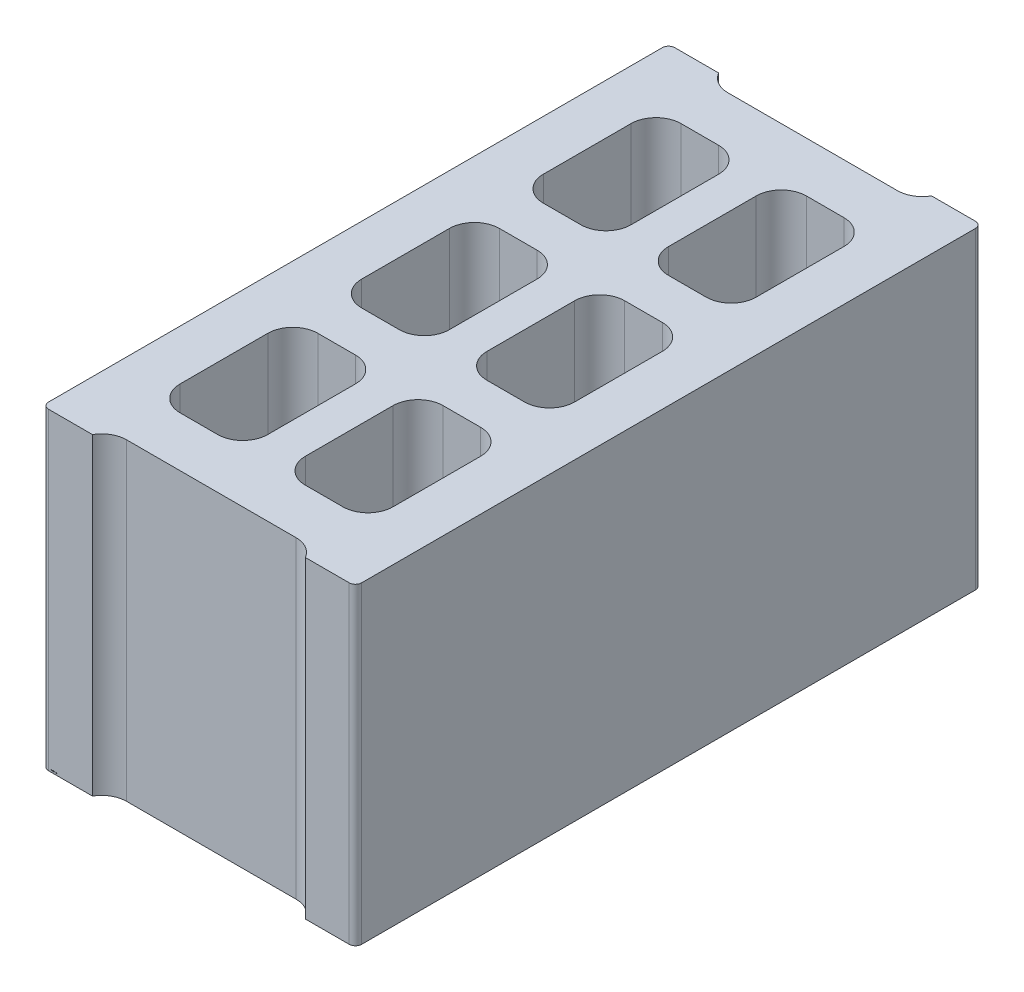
SolidWorks part; units mm, degrees
ref_plane "Plan de face" through (0, 0, 0) normal (0, 0, 1) x (1, 0, 0)
ref_plane "Plan de dessus" through (0, 0, 0) normal (0, 1, 0) x (1, 0, 0)
ref_plane "Plan de droite" through (0, 0, 0) normal (1, 0, 0) x (0, 0, -1)
sketch "Esquisse1" plane through (0, 0, 0) normal (0, 1, 0) x (1, 0, 0)
  line L0 (0, -20.2628) -> (0, 58.4186) construction
  line L1 (-24.3225, 0) -> (29.7425, 0) construction
  line L2 (25, -20.2628) -> (25, 58.4186) construction
  line L3 (-24.3225, 50) -> (34.6841, 50) construction
  line L4 (4, 55.6667) -> (4, -3.7395) construction
  line L5 (-3.5126, 49) -> (27.2256, 49) construction
  line L6 (-17.7609, 25) -> (23.5775, 25) construction
  line L7 (12.5, 55.6667) -> (12.5, -13.5587) construction
  line L8 (21, 0) -> (24.5, 0)
  line L9 (21, 55.6667) -> (21, -3.7395) construction
  line L10 (-3.5126, 1) -> (27.2256, 1) construction
  line L11 (4, 49) -> (21, 49)
  line L12 (4, 49) -> (4, 50)
  line L14 (21, 49) -> (21, 50)
  line L15 (4, 1) -> (21, 1)
  line L16 (4, 1) -> (4, 0)
  line L17 (21, 50) -> (24.5, 50)
  line L18 (21, 1) -> (21, 0)
  line L19 (0.5, 50) -> (4, 50)
  line L20 (0, 49.5) -> (0, 0.5)
  line L21 (0.5, 0) -> (4, 0)
  line L22 (25, 49.5) -> (25, 0.5)
  arc A0 (0.5, 50) -> (0, 49.5) centre (0.5, 49.5) ccw
  arc A1 (24.5, 50) -> (25, 49.5) centre (24.5, 49.5) cw
  arc A2 (24.5, 0) -> (25, 0.5) centre (24.5, 0.5) ccw
  arc A3 (0, 0.5) -> (0.5, 0) centre (0.5, 0.5) ccw
  dimension "D6" = 0.5
  dimension "D1" = 25
  dimension "D2" = 50
  dimension "D3" = 25
  dimension "D4" = 12.5
  dimension "D5" = 4
  dimension "D7" = 1
extrude "Extrusion1" add sketch "Esquisse1" along normal blind 25
sketch "Esquisse2" plane through (0, 0, 0) normal (0, -1, 0) x (1, 0, 0)
  line L0 (0, 2.4119) -> (0, -60.8727) construction
  line L1 (-5.7031, 0) -> (29.0572, 0) construction
  line L2 (29.0572, -25) -> (-5.7031, -25) construction
  line L3 (12.5, 9.4676) -> (12.5, -60.8727) construction
  line L4 (4, 9.4676) -> (4, -52.8814) construction
  line L5 (14, -16) -> (14, -5)
  line L6 (-5.7031, -5) -> (39.022, -5) construction
  line L7 (-5.7031, -16) -> (39.022, -16) construction
  line L8 (-5.7031, -19.5) -> (39.022, -19.5) construction
  line L9 (11, -52.8814) -> (11, 9.4676) construction
  line L10 (-5.7031, -45) -> (39.022, -45) construction
  line L11 (-5.7031, -34) -> (39.022, -34) construction
  line L12 (-5.7031, -30.5) -> (39.022, -30.5) construction
  line L13 (4, -45) -> (11, -45)
  line L14 (4, -45) -> (4, -34)
  line L15 (4, -34) -> (11, -34)
  line L16 (11, -45) -> (11, -34)
  line L17 (4, -30.5) -> (11, -30.5)
  line L18 (4, -30.5) -> (4, -19.5)
  line L19 (4, -19.5) -> (11, -19.5)
  line L20 (11, -30.5) -> (11, -19.5)
  line L21 (4, -16) -> (11, -16)
  line L22 (4, -16) -> (4, -5)
  line L23 (4, -5) -> (11, -5)
  line L24 (11, -16) -> (11, -5)
  line L25 (21, -5) -> (14, -5)
  line L26 (21, -16) -> (21, -5)
  line L27 (21, -16) -> (14, -16)
  line L28 (14, -30.5) -> (14, -19.5)
  line L29 (21, -19.5) -> (14, -19.5)
  line L30 (21, -30.5) -> (21, -19.5)
  line L31 (21, -30.5) -> (14, -30.5)
  line L32 (14, -45) -> (14, -34)
  line L33 (21, -34) -> (14, -34)
  line L34 (21, -45) -> (21, -34)
  line L35 (21, -45) -> (14, -45)
  dimension "D1" = 25
  dimension "D2" = 12.5
  dimension "D3" = 1.5
  dimension "D4" = 5
  dimension "D5" = 11
  dimension "D6" = 3.5
  dimension "D7" = 4
extrude "Enlèv. mat.-Extru.1" cut sketch "Esquisse2" against normal blind 25
fillet "Congé1" radius 2 24 edges at (14, 12.5, -16) (14, 12.5, -30.5) (14, 12.5, -45) (4, 12.5, -45) (4, 12.5, -30.5) (4, 12.5, -16) (14, 12.5, -5) (14, 12.5, -19.5) (14, 12.5, -34) (4, 12.5, -34) (4, 12.5, -19.5) (4, 12.5, -5) (21, 12.5, -16) (11, 12.5, -16) (11, 12.5, -30.5) (21, 12.5, -30.5) (21, 12.5, -45) (11, 12.5, -45) (21, 12.5, -34) (11, 12.5, -34) (21, 12.5, -19.5) (11, 12.5, -19.5) (21, 12.5, -5) (11, 12.5, -5)
fillet "Congé2" radius 2 4 edges at (21, 12.5, -49) (4, 12.5, -49) (21, 12.5, -1) (4, 12.5, -1)
sketch "Esquisse3" plane through (0, 0, 0) normal (0, 0, 1) x (1, 0, 0)
  text T0 "www.a4.fr" font "Century Gothic" height 0.1
extrude "Enlèv. mat.-Extru.2" cut sketch "Esquisse3" against normal blind 0.05
